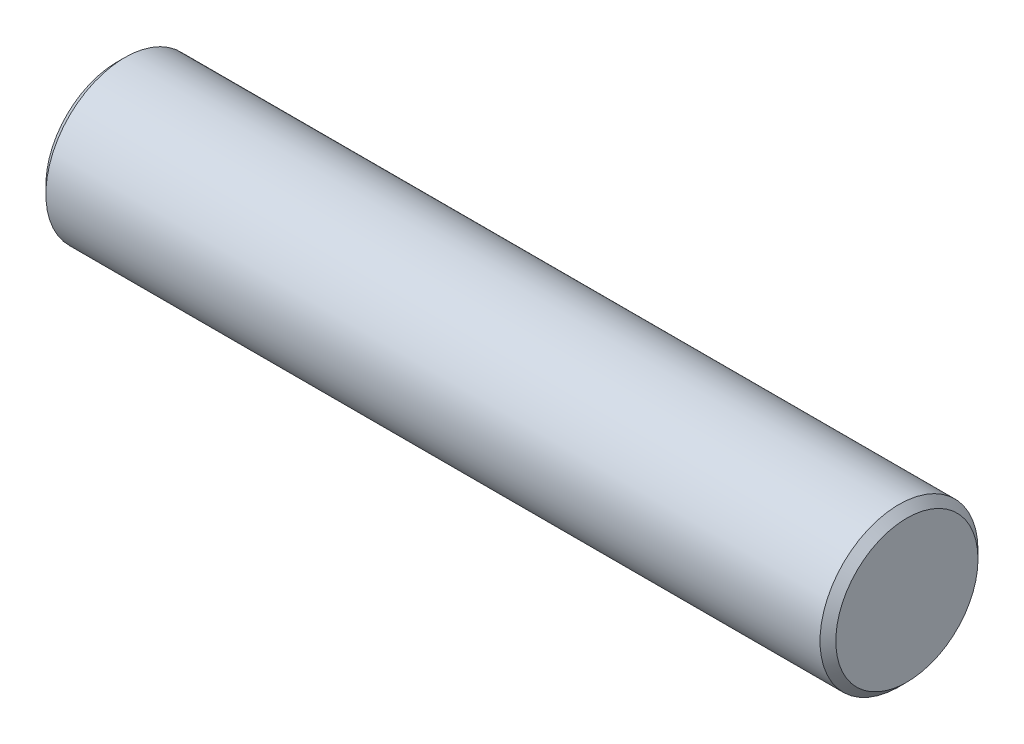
SolidWorks part; units mm, degrees
ref_plane "Спереди" through (0, 0, 0) normal (0, 0, 1) x (1, 0, 0)
ref_plane "Сверху" through (0, 0, 0) normal (0, 1, 0) x (1, 0, 0)
ref_plane "Справа" through (0, 0, 0) normal (1, 0, 0) x (0, 0, -1)
sketch "Эскиз1" plane through (0, 0, 0) normal (1, 0, 0) x (0, 0, -1)
  circle A0 centre (0, 0) radius 5
  dimension "D1" = 10
extrude "Бобышка-Вытянуть1" add sketch "Эскиз1" along normal mid plane 50
chamfer "Фаска1" distance 0.5 angle 45 2 edges at (-25, 0, -5) (25, 0, -5)
